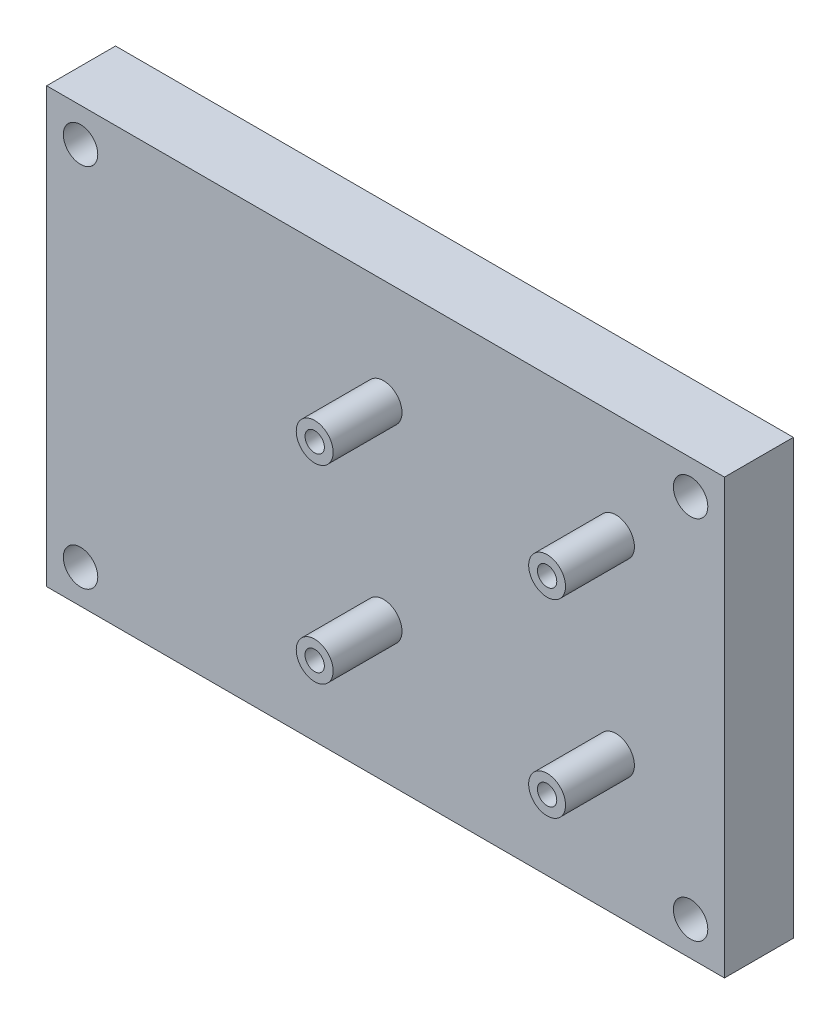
SolidWorks part; units mm, degrees
ref_plane "Front Plane" through (0, 0, 0) normal (0, 0, 1) x (1, 0, 0)
ref_plane "Top Plane" through (0, 0, 0) normal (0, 1, 0) x (1, 0, 0)
ref_plane "Right Plane" through (0, 0, 0) normal (1, 0, 0) x (0, 0, -1)
sketch "Sketch1" plane through (0, 0, 0) normal (0, 0, 1) x (1, 0, 0)
  line L1 (0, 0) -> (125, 0)
  line L2 (0, 0) -> (0, 80)
  line L3 (0, 80) -> (125, 80)
  line L4 (125, 0) -> (125, 80)
  dimension "D1" = 125
  dimension "D2" = 80
extrude "Boss-Extrude1" add sketch "Sketch1" along normal blind 12.7
sketch "Sketch2" plane through (0, 0, 12.7) normal (0, 0, 1) x (1, 0, 0)
  line L0 (0, 80) -> (0, 0) construction
  line L2 (125, 80) -> (0, 80) construction
  line L3 (125, 0) -> (125, 80) construction
  line L4 (0, 0) -> (125, 0) construction
  circle A0 centre (118.75, 73.75) radius 3.175
  circle A1 centre (6.25, 6.25) radius 3.175
  circle A2 centre (118.75, 6.25) radius 3.175
  circle A3 centre (6.25, 73.75) radius 3.175
  point P8 (120.223, 74.5725)
  point P9 (5.8878, 5.2997)
  point P10 (120.223, 5.2997)
  point P15 (7.1638, 80)
  dimension "D1" = 6.25
  dimension "D2" = 6.25
  dimension "D3" = 6.25
  dimension "D4" = 6.25
  dimension "D5" = 6.25
  dimension "D6" = 6.25
  dimension "D7" = 6.25
  dimension "D8" = 6.25
extrude "Cut-Extrude1" cut sketch "Sketch2" against normal through all
sketch "Sketch3" plane through (0, 0, 12.7) normal (0, 0, 1) x (1, 0, 0)
  circle A0 centre (62.1284, 60.5614) radius 3.4019
  circle A1 centre (104.9909, 60.5614) radius 3.4019
  circle A2 centre (62.1284, 25.6364) radius 3.4019
  circle A3 centre (104.9884, 25.6364) radius 3.4019
  point P8 (63.8374, 58.3093)
  point P9 (23.8246, 30.5964)
  point P10 (0, 0)
  point P11 (63.8374, 30.5964)
  point P12 (56.9389, 59.3612)
  point P13 (25.0683, 34.1118)
  point P14 (56.9389, 34.1118)
  dimension "D1" = 42.8625
  dimension "D2" = 34.925
  dimension "D3" = 42.86
  dimension "D4" = 34.925
extrude "Boss-Extrude2" add sketch "Sketch3" along normal blind 12.7
sketch "Sketch5" plane through (0, 0, 25.4) normal (0, 0, 1) x (1, 0, 0)
  point P0 (62.1284, 60.5614)
  point P3 (104.9884, 25.6364)
  point P4 (62.1284, 25.6364)
  point P6 (104.9909, 60.5614)
  point P8 (0, 0)
hole_wizard "#28 (0.1405) Diameter Hole1" positions "3DSketch1" profile "Sketch9" hole size "#28" standard "ANSI Inch"
sketch3d "3DSketch1"
  point P0 (62.1284, 60.5614, 25.4)
  point P3 (104.9909, 60.5614, 25.4)
  point P6 (62.1284, 25.6364, 25.4)
  point P9 (104.9884, 25.6364, 25.4)
sketch "Sketch9" plane through (62.1284, 60.5614, 25.4) normal (1, 0, 0) x (0, -1, 0)
  line L0 (0, 0) -> (0, 25.4)
  line L1 (0, 25.4) -> (1.7843, 25.4)
  line L2 (1.7843, 25.4) -> (1.7844, 0)
  line L5 (1.7844, 0) -> (0, 0)
  line L11 (0, -6.35) -> (0, 107.95) construction
  dimension "Thru Hole Dia." = 3.5687
  dimension "Thru Hole Depth" = 25.4
